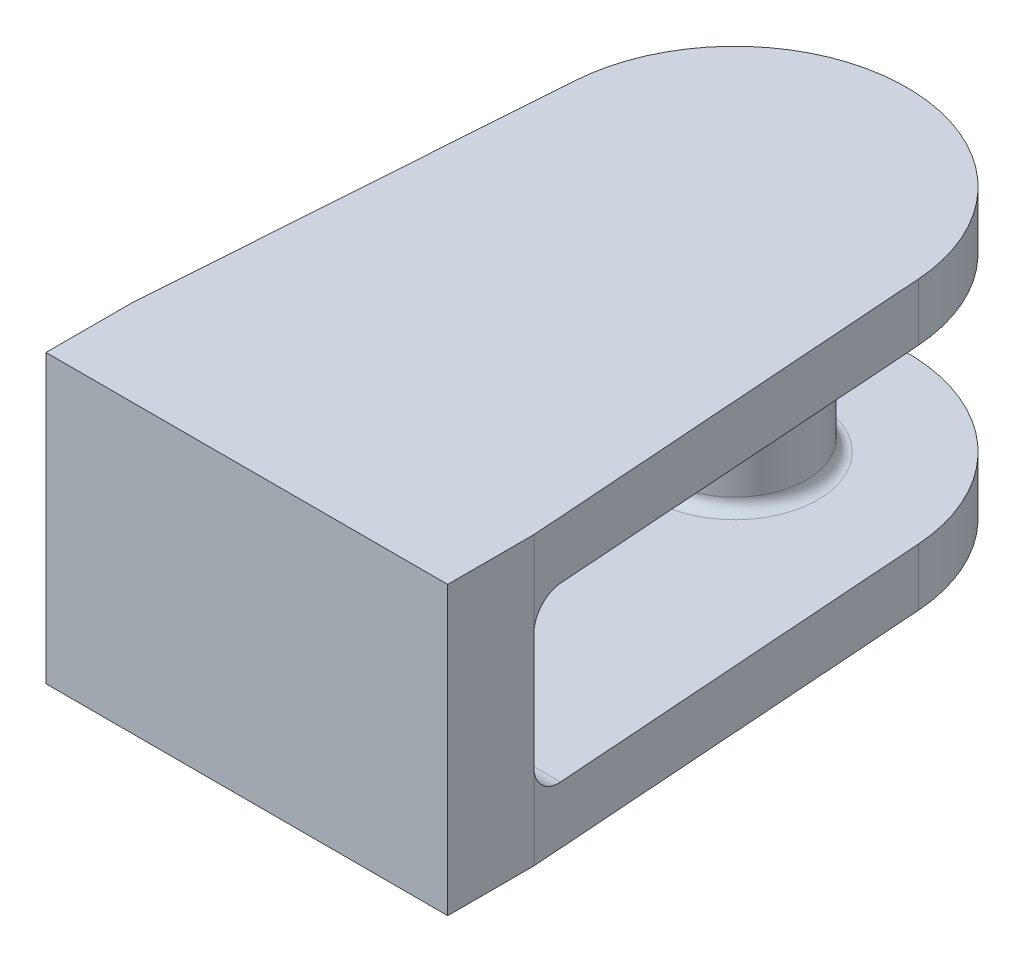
SolidWorks part; units mm, degrees
ref_plane "Front Plane" through (0, 0, 0) normal (0, 0, 1) x (1, 0, 0)
ref_plane "Top Plane" through (0, 0, 0) normal (0, 1, 0) x (1, 0, 0)
ref_plane "Right Plane" through (0, 0, 0) normal (1, 0, 0) x (0, 0, -1)
sketch "Sketch1" plane through (0, 0, 0) normal (0, 1, 0) x (1, 0, 0)
  circle A0 centre (0, 0) radius 15.875
  dimension "D1" = 31.75
extrude "Extrude1" add sketch "Sketch1" along normal blind 38.1
sketch "Sketch2" plane through (0, 38.1, 0) normal (0, 1, 0) x (1, 0, 0)
  line L0 (-44.45, -88.9) -> (-38.006, 2.6744)
  line L1 (38.006, 2.6744) -> (44.45, -88.9)
  line L5 (0, 0) -> (0, -127) construction
  line L6 (-44.45, -88.9) -> (44.45, -88.9)
  arc A0 (-38.006, 2.6744) -> (38.006, 2.6744) centre (0, 0) cw
  circle A1 centre (0, 0) radius 15.875 construction
  dimension "D2" = 88.9
  dimension "D3" = 38.1
  dimension "D1" = 88.9
extrude "Extrude2" add sketch "Sketch2" along normal blind 12.7
sketch "Sketch5" plane through (0, 0, 0) normal (0, -1, 0) x (1, 0, 0)
  line L3 (38.006, -2.6744) -> (44.45, 88.9)
  line L4 (44.45, 88.9) -> (-44.45, 88.9)
  line L5 (-44.45, 88.9) -> (-38.006, -2.6744)
  line L6 (38.006, -2.6744) -> (44.45, 88.9)
  line L7 (44.45, 88.9) -> (-44.45, 88.9)
  line L8 (-44.45, 88.9) -> (-38.006, -2.6744)
  arc A1 (-38.006, -2.6744) -> (38.006, -2.6744) centre (0, 0) ccw
  arc A2 (-38.006, -2.6744) -> (38.006, -2.6744) centre (0, 0) ccw
  dimension "D1" = 0
extrude "Extrude5" add sketch "Sketch5" along normal blind 12.7
sketch "Sketch6" plane through (0, 0, 88.9) normal (0, 0, 1) x (1, 0, 0)
  line L1 (-44.45, 50.8) -> (44.45, 50.8)
  line L2 (-44.45, 50.8) -> (-44.45, -12.7)
  line L3 (-44.45, -12.7) -> (44.45, -12.7)
  line L4 (44.45, 50.8) -> (44.45, -12.7)
extrude "Extrude6" add sketch "Sketch6" along normal blind 19.05
fillet "Fillet3" radius 6.35 2 edges
fillet "Fillet4" radius 2.54 2 edges at (0, 0, -15.875) (0, 38.1, 15.875)
